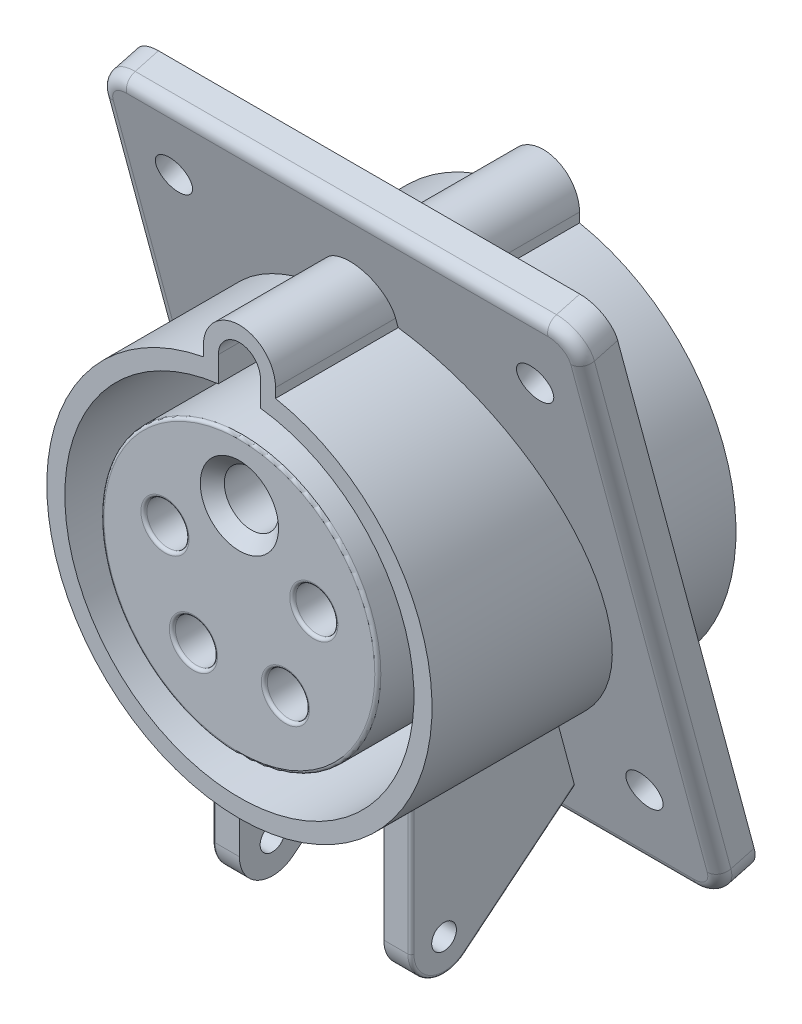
SolidWorks part; units mm, degrees
ref_plane "Спереди" through (0, 0, 0) normal (0, 0, 1) x (1, 0, 0)
ref_plane "Сверху" through (0, 0, 0) normal (0, 1, 0) x (1, 0, 0)
ref_plane "Справа" through (0, 0, 0) normal (1, 0, 0) x (0, 0, -1)
sketch "Эскиз1" plane through (0, 0, 0) normal (0, 0, 1) x (1, 0, 0)
  circle A0 centre (0, 0) radius 32
  dimension "D1" = 64
extrude "Бобышка-Вытянуть1" add sketch "Эскиз1" along normal blind 52
sketch "Эскиз2" plane through (0, 0, 52) normal (0, 0, 1) x (1, 0, 0)
  circle A0 centre (0, 0) radius 29
  dimension "D1" = 58
extrude "Вырез-Вытянуть1" cut sketch "Эскиз2" against normal blind 46
sketch "Эскиз3" plane through (0, 0, 0) normal (0, 0, -1) x (-1, 0, 0)
  circle A0 centre (0, 0) radius 24
  dimension "D1" = 48
extrude "Вырез-Вытянуть2" cut sketch "Эскиз3" against normal blind 46
sketch "Эскиз4" plane through (0, 0, 0) normal (0, 0, -1) x (-1, 0, 0)
  circle A0 centre (0, 0) radius 26
  circle A1 centre (0, 0) radius 48.7983
  dimension "D1" = 52
extrude "Вырез-Вытянуть3" cut sketch "Эскиз4" against normal blind 1.5
sketch "Эскиз5" plane through (0, 0, 52) normal (0, 0, 1) x (1, 0, 0)
  line L1 (-6, 33) -> (-6, 30.5387)
  line L2 (-6, 30.5387) -> (6, 30.5387)
  line L3 (6, 30.5387) -> (6, 33)
  arc A1 (6, 33) -> (-6, 33) centre (0, 33) ccw
  dimension "D1" = 12
extrude "Бобышка-Вытянуть2" add sketch "Эскиз5" against normal up to surface (50.5 mm away)
sketch "Эскиз6" plane through (0, 0, 52) normal (0, 0, 1) x (1, 0, 0)
  line L0 (-3.4963, 33) -> (-3.4963, 27.1224)
  line L1 (-3.4963, 27.1224) -> (3.4963, 27.1224)
  line L2 (3.4963, 27.1224) -> (3.4963, 33)
  arc A0 (3.4963, 33) -> (-3.4963, 33) centre (0, 33) ccw
extrude "Вырез-Вытянуть4" cut sketch "Эскиз6" against normal up to surface (46 mm away)
sketch "Эскиз7" plane through (0, 0, 0) normal (1, 0, 0) x (0, 0, -1)
  line L0 (-36.2467, 48.6283) -> (-30.4521, 50.1848)
  line L1 (-10.9858, -45.4163) -> (-5.1912, -43.8598)
  line L3 (-36.2467, 48.6283) -> (-10.9858, -45.4163)
  line L8 (-30.4521, 50.1848) -> (-5.1912, -43.8598)
extrude "Бобышка-Вытянуть3" add sketch "Эскиз7" along normal blind 40 and the other way blind 40
fillet "Скругление1" radius 5 4 edges at (40, -44.6381, 8.0885) (40, 49.4065, 33.3494) (-40, 49.4065, 33.3494) (-40, -44.6381, 8.0885)
sketch "Эскиз8" plane through (0, 0, 52) normal (0, 0, 1) x (1, 0, 0)
  line L0 (-3.4963, 33) -> (-3.4963, 28.7885)
  line L1 (3.4963, 33) -> (3.4963, 28.7885)
  arc A0 (-3.4963, 28.7885) -> (3.4963, 28.7885) centre (0, 0) ccw
  arc A1 (3.4963, 33) -> (-3.4963, 33) centre (0, 33) ccw
extrude "Вырез-Вытянуть5" cut sketch "Эскиз8" against normal blind 45
fillet "Скругление2" radius 2 8 edges at (-38.5355, 47.214, 35.8668) (0, 48.6283, 36.2467) (38.5355, 47.214, 35.8668) (40, 1.606, 23.6163) (38.5355, -44.002, 11.3657) (0, -45.4163, 10.9858) (-38.5355, -44.002, 11.3657) (-40, 1.606, 23.6163)
sketch "Эскиз9" plane through (0, -5.8085, 21.6247) normal (0, -0.2594, 0.9658) x (1, 0, 0)
  circle A0 centre (30, 43.3512) radius 3
  circle A1 centre (-30, 43.3512) radius 3
  circle A2 centre (-30, -26.6488) radius 3
  circle A3 centre (30, -26.6488) radius 3
extrude "Вырез-Вытянуть6" cut sketch "Эскиз9" against normal blind 40 draft 4
sketch "Эскиз10" plane through (0, 0, 1.5) normal (0, 0, -1) x (-1, 0, 0)
  circle A0 centre (0, 0) radius 23
extrude "Бобышка-Вытянуть4" add sketch "Эскиз10" against normal up to surface (50.5 mm away) separate body
sketch "Эскиз16" plane through (0, 0, 52) normal (0, 0, 1) x (1, 0, 0)
  circle A1 centre (0, 13) radius 3.5
  circle A2 centre (12.3637, 4.0172) radius 3.5
  circle A3 centre (7.6412, -10.5172) radius 3.5
  circle A4 centre (-7.6412, -10.5172) radius 3.5
  circle A5 centre (-12.3637, 4.0172) radius 3.5
  point P16 (0, 0)
  dimension "D1" = 7
  dimension "D2" = 5
fillet "Скругление4" radius 0.5 1 edges at (23, 0, 52)
sketch "Эскиз13" plane through (0, 0, 0) normal (1, 0, 0) x (0, 0, -1)
  line L0 (-40, -49.5) -> (-40, -25.2433)
  line L1 (-40, -25.2433) -> (-16.4044, -25.2433)
  line L2 (-12.2829, -40.5875) -> (-34.9497, 43.7995) construction
  line L3 (-16.4044, -25.2433) -> (-12.7448, -38.8676)
  line L4 (-12.7448, -38.8676) -> (-31.0257, -53.7637)
  arc A0 (-40, -49.5) -> (-31.0257, -53.7637) centre (-34.5, -49.5) ccw
  circle A1 centre (-34.5, -49.5) radius 2.0547
extrude "Бобышка-Вытянуть5" add sketch "Эскиз13" along normal blind 16.5 and the other way blind 16.5
sketch "Эскиз14" plane through (0, 0, 52) normal (0, 0, 1) x (1, 0, 0)
  line L0 (-15.4639, -24.533) -> (15.7926, -24.3227)
  arc A0 (-15.4639, -24.533) -> (15.7926, -24.3227) centre (0, 0) ccw
extrude "Вырез-Вытянуть9" cut sketch "Эскиз14" against normal up to surface (46 mm away)
sketch "Эскиз15" plane through (0, 0, 40) normal (0, 0, 1) x (1, 0, 0)
  line L0 (-12, -60.389) -> (12, -60.389)
  line L2 (12, -60.389) -> (12, -29.6648)
  line L3 (-12, -60.389) -> (-12, -29.6648)
  arc A0 (-12, -29.6648) -> (12, -29.6648) centre (0, 0) ccw
extrude "Вырез-Вытянуть10" cut sketch "Эскиз15" against normal blind 19.5
fillet "Скругление5" radius 0.5 6 edges at (-16.5, -46.3157, 21.8853) (-16.5, -54.4679, 36.8603) (16.5, -46.3157, 21.8853) (16.5, -54.4679, 36.8603) (-16.5, -38.459, 40) (16.5, -38.459, 40)
extrude "Вырез-Вытянуть11" cut sketch "Эскиз16" against normal blind 46
sketch "Эскиз17" plane through (0, 0, 52) normal (0, 0, 1) x (1, 0, 0)
  circle A0 centre (0, 13) radius 4.5
  dimension "D1" = 9
extrude "Вырез-Вытянуть12" cut sketch "Эскиз17" against normal up to surface (46 mm away)
fillet "Скругление6" radius 0.5 4 edges at (15.8637, 4.0172, 52) (11.1412, -10.5172, 52) (-4.1412, -10.5172, 52) (-8.8637, 4.0172, 52)
chamfer "Фаска1" distance 2 angle 45 1 edges at (4.5, 13, 52)
